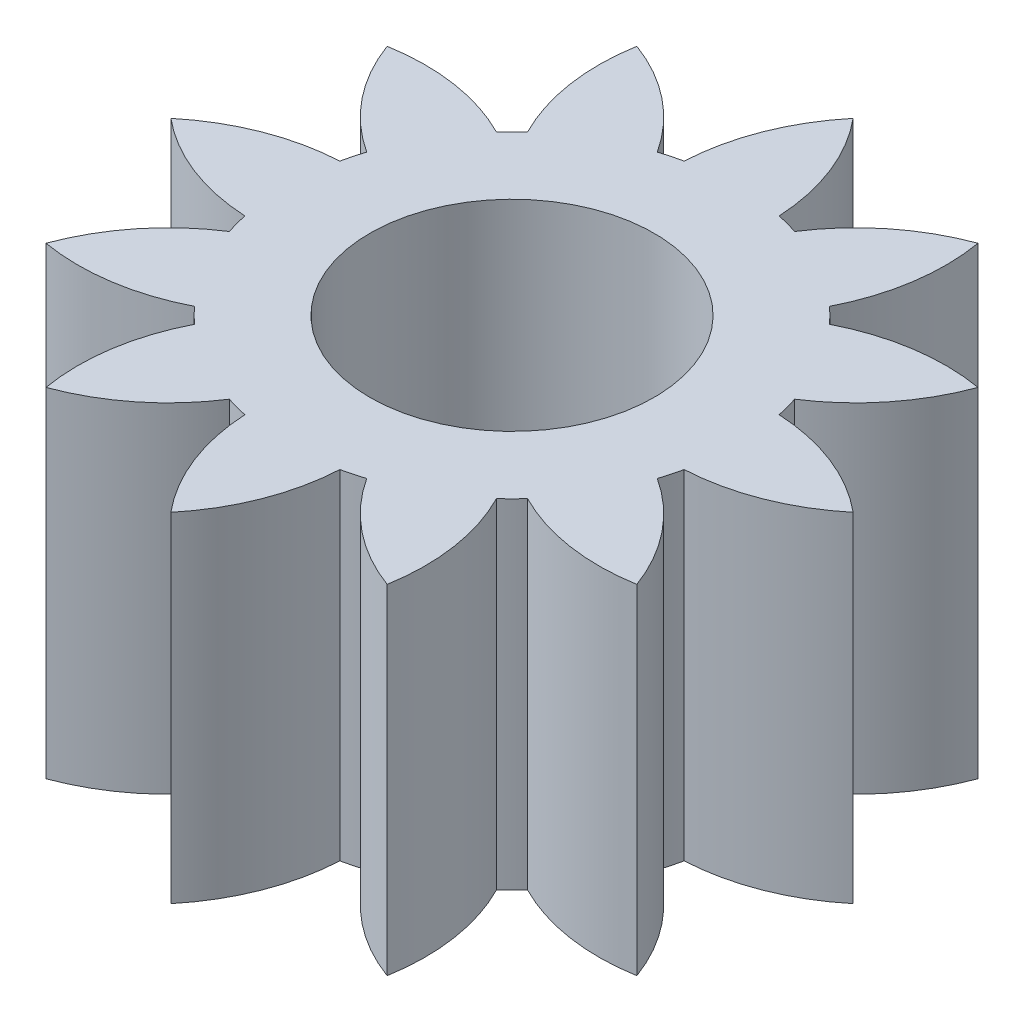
SolidWorks part; units mm, degrees
ref_plane "Front Plane" through (0, 0, 0) normal (0, 0, 1) x (1, 0, 0)
ref_plane "Top Plane" through (0, 0, 0) normal (0, 1, 0) x (1, 0, 0)
ref_plane "Right Plane" through (0, 0, 0) normal (1, 0, 0) x (0, 0, -1)
sketch "Sketch1" plane through (0, 0, 0) normal (0, 1, 0) x (1, 0, 0)
  circle A0 centre (0, 0) radius 2.4511
  circle A1 centre (0, 0) radius 3.8735
  dimension "D1" = 4.9022
  dimension "D2" = 7.747
extrude "Boss-Extrude1" add sketch "Sketch1" along normal blind 5.842
sketch "Sketch2" plane through (0, 0, 0) normal (0, 1, 0) x (1, 0, 0)
  line L0 (-0.8128, 3.8735) -> (0.8128, 3.8735) construction
  line L1 (0, 3.8735) -> (0, 5.8801) construction
  arc A0 (0, 5.8801) -> (-0.8183, 3.7861) centre (2.7331, 3.6051) ccw
  circle A1 centre (0, 0) radius 3.8735 construction
  arc A2 (0, 5.8801) -> (0.8183, 3.7861) centre (-2.7331, 3.6051) cw
  arc A3 (-0.8183, 3.7861) -> (0.8183, 3.7861) centre (0, 0) cw
  arc A4 (1.1843, 3.688) -> (2.6017, 2.8697) centre (0, 0) cw
  arc A5 (2.9401, 5.0923) -> (2.6017, 2.8697) centre (-0.5643, 4.4887) cw
  arc A6 (2.9401, 5.0923) -> (1.1843, 3.688) centre (4.1695, 1.7556) ccw
  arc A7 (2.8697, 2.6017) -> (3.688, 1.1843) centre (0, 0) cw
  arc A8 (5.0923, 2.94) -> (3.688, 1.1843) centre (1.7556, 4.1695) cw
  arc A9 (5.0923, 2.94) -> (2.8697, 2.6017) centre (4.4887, -0.5643) ccw
  arc A10 (3.7861, 0.8183) -> (3.7861, -0.8183) centre (0, 0) cw
  arc A11 (5.8801, 0) -> (3.7861, -0.8183) centre (3.6051, 2.7331) cw
  arc A12 (5.8801, 0) -> (3.7861, 0.8183) centre (3.6051, -2.7331) ccw
  arc A13 (3.688, -1.1843) -> (2.8697, -2.6017) centre (0, 0) cw
  arc A14 (5.0923, -2.9401) -> (2.8697, -2.6017) centre (4.4887, 0.5643) cw
  arc A15 (5.0923, -2.9401) -> (3.688, -1.1843) centre (1.7556, -4.1695) ccw
  arc A16 (2.6017, -2.8697) -> (1.1843, -3.688) centre (0, 0) cw
  arc A17 (2.94, -5.0923) -> (1.1843, -3.688) centre (4.1695, -1.7556) cw
  arc A18 (2.94, -5.0923) -> (2.6017, -2.8697) centre (-0.5643, -4.4887) ccw
  arc A19 (0.8183, -3.7861) -> (-0.8183, -3.7861) centre (0, 0) cw
  arc A20 (0, -5.8801) -> (-0.8183, -3.7861) centre (2.7331, -3.6051) cw
  arc A21 (0, -5.8801) -> (0.8183, -3.7861) centre (-2.7331, -3.6051) ccw
  arc A22 (-1.1843, -3.688) -> (-2.6017, -2.8697) centre (0, 0) cw
  arc A23 (-2.9401, -5.0923) -> (-2.6017, -2.8697) centre (0.5643, -4.4887) cw
  arc A24 (-2.9401, -5.0923) -> (-1.1843, -3.688) centre (-4.1695, -1.7556) ccw
  arc A25 (-2.8697, -2.6017) -> (-3.688, -1.1843) centre (0, 0) cw
  arc A26 (-5.0923, -2.94) -> (-3.688, -1.1843) centre (-1.7556, -4.1695) cw
  arc A27 (-5.0923, -2.94) -> (-2.8697, -2.6017) centre (-4.4887, 0.5643) ccw
  arc A28 (-3.7861, -0.8183) -> (-3.7861, 0.8183) centre (0, 0) cw
  arc A29 (-5.8801, 0) -> (-3.7861, 0.8183) centre (-3.6051, -2.7331) cw
  arc A30 (-5.8801, 0) -> (-3.7861, -0.8183) centre (-3.6051, 2.7331) ccw
  arc A31 (-3.688, 1.1843) -> (-2.8697, 2.6017) centre (0, 0) cw
  arc A32 (-5.0923, 2.9401) -> (-2.8697, 2.6017) centre (-4.4887, -0.5643) cw
  arc A33 (-5.0923, 2.9401) -> (-3.688, 1.1843) centre (-1.7556, 4.1695) ccw
  arc A34 (-2.6017, 2.8697) -> (-1.1843, 3.688) centre (0, 0) cw
  arc A35 (-2.94, 5.0923) -> (-1.1843, 3.688) centre (-4.1695, 1.7556) cw
  arc A36 (-2.94, 5.0923) -> (-2.6017, 2.8697) centre (0.5643, 4.4887) ccw
  point P3 (0, 3.8735)
  point P70 (0, 0)
  dimension "D2" = 3.556
  dimension "D1" = 1.6256
  dimension "D3" = 2.0066
  dimension "D4" = 12
extrude "Boss-Extrude2" add sketch "Sketch2" along normal up to surface (5.842 mm away)
